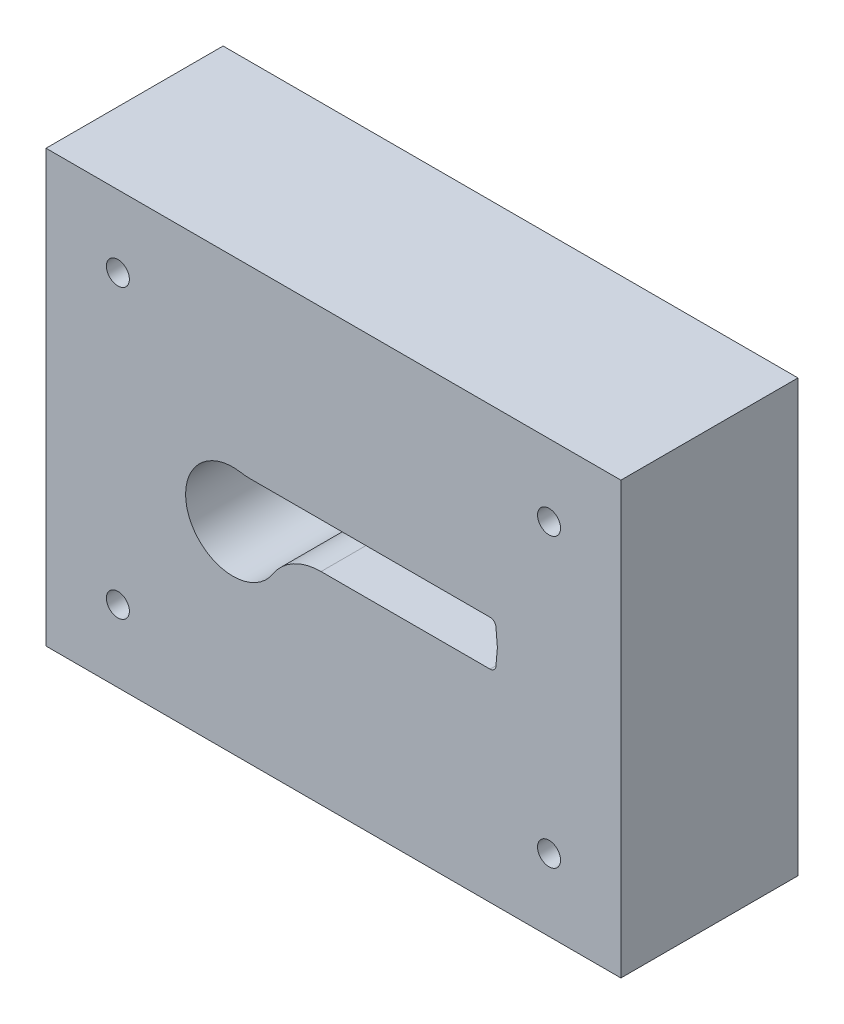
SolidWorks part; units mm, degrees
ref_plane "Plan1" through (0, 0, 0) normal (0, 0, 1) x (1, 0, 0)
ref_plane "Plan2" through (0, 0, 0) normal (0, 1, 0) x (1, 0, 0)
ref_plane "Plan3" through (0, 0, 0) normal (1, 0, 0) x (0, 0, -1)
sketch "Esquisse1" plane through (0, 0, 0) normal (0, 0, 1) x (1, 0, 0)
  line L1 (0, 0) -> (200, 0)
  line L2 (0, 0) -> (0, 150)
  line L3 (0, 150) -> (200, 150)
  line L4 (200, 0) -> (200, 150)
  dimension "D1" = 150
  dimension "D2" = 200
extrude "Base-Extrusion" add sketch "Esquisse1" along normal blind 65
sketch "Esquisse2" plane through (0, 0, 65) normal (0, 0, 1) x (1, 0, 0)
  line L0 (-10, 70) -> (90, 70) construction
  line L1 (0, 0) -> (200, 0) construction
  line L2 (20.3045, 78.12) -> (209.4484, 78.12) construction
  line L3 (71.0782, 85.935) -> (154.4898, 85.935)
  line L4 (156.5121, 84.0819) -> (157.0337, 78.12)
  line L5 (156.5121, 72.1581) -> (157.0337, 78.12)
  line L6 (95.6814, 70.305) -> (154.4898, 70.305)
  line L7 (200, 0) -> (200, 150) construction
  arc A0 (67.7404, 86.2151) -> (78.8329, 61.1069) centre (65, 70) ccw
  arc A1 (154.4898, 85.935) -> (156.5121, 84.0819) centre (154.4898, 83.905) cw
  arc A2 (71.0782, 85.935) -> (67.7404, 86.2151) centre (71.0782, 105.965) cw
  arc A3 (154.4898, 70.305) -> (156.5121, 72.1581) centre (154.4898, 72.335) ccw
  arc A4 (95.6814, 70.305) -> (78.8329, 61.1069) centre (95.6814, 50.275) ccw
  point P13 (156.35, 85.935)
  dimension "D2" = 32.89
  dimension "D6" = 91.35
  dimension "D7" = 2.03
  dimension "D8" = 20.03
  dimension "D9" = 20.03
  dimension "D10" = 135
  dimension "D1" = 70
  dimension "D3" = 8.12
  dimension "D4" = 7.815
  dimension "D5" = 95
extrude "Enlèv. mat.-Extru.1" cut sketch "Esquisse2" against normal through all
sketch "Esquisse3" plane through (0, 0, 0) normal (0, 0, -1) x (-1, 0, 0)
  line L5 (-210.7053, 159.8634) -> (12.6195, 159.8634)
  line L6 (-210.7053, 159.8634) -> (-210.7053, -13.0538)
  line L7 (-210.7053, -13.0538) -> (12.6195, -13.0538)
  line L8 (-161.049, 78.12) -> (-160.4969, 71.8095)
  line L9 (-160.4969, 84.4305) -> (-161.049, 78.12)
  line L10 (-71.0782, 89.935) -> (-154.4898, 89.935)
  line L11 (-154.4898, 66.305) -> (-95.6814, 66.305)
  line L12 (-161.049, 78.12) -> (-160.4969, 71.8095)
  line L13 (-160.4969, 84.4305) -> (-161.049, 78.12)
  line L14 (-71.0782, 89.935) -> (-154.4898, 89.935)
  line L15 (-154.4898, 66.305) -> (-95.6814, 66.305)
  line L16 (12.6195, 159.8634) -> (12.6195, -13.0538)
  arc A10 (-160.4969, 71.8095) -> (-154.4898, 66.305) centre (-154.4898, 72.335) ccw
  arc A11 (-154.4898, 89.935) -> (-160.4969, 84.4305) centre (-154.4898, 83.905) ccw
  arc A12 (-71.0782, 89.935) -> (-68.407, 90.1591) centre (-71.0782, 105.965) ccw
  arc A13 (-82.1976, 58.9437) -> (-68.407, 90.1591) centre (-65, 70) ccw
  arc A14 (-82.1976, 58.9437) -> (-95.6814, 66.305) centre (-95.6814, 50.275) ccw
  arc A15 (-160.4969, 71.8095) -> (-154.4898, 66.305) centre (-154.4898, 72.335) ccw
  arc A16 (-154.4898, 89.935) -> (-160.4969, 84.4305) centre (-154.4898, 83.905) ccw
  arc A17 (-71.0782, 89.935) -> (-68.407, 90.1591) centre (-71.0782, 105.965) ccw
  arc A18 (-82.1976, 58.9437) -> (-68.407, 90.1591) centre (-65, 70) ccw
  arc A19 (-82.1976, 58.9437) -> (-95.6814, 66.305) centre (-95.6814, 50.275) ccw
  dimension "D1" = 4
extrude "Enlèv. mat.-Extru.2" cut sketch "Esquisse3" against normal blind 3.4
fillet "Congé1" radius 3
hole_wizard "Trou taraudé M10x1.52" positions "Esquisse9" profile "Esquisse8" tap size "M10x1.5" standard "ISO"
sketch "Esquisse9" plane through (0, 0, 65) normal (0, 0, 1) x (1, 0, 0)
  line L0 (200, 150) -> (0, 150) construction
  line L1 (200, 0) -> (200, 150) construction
  line L3 (0, 0) -> (200, 0) construction
  point P0 (25, 125)
  point P1 (175, 125)
  point P2 (175, 25)
  point P3 (25, 25)
  dimension "D1" = 150
  dimension "D2" = 150
  dimension "D3" = 100
  dimension "D4" = 100
  dimension "D5" = 25
  dimension "D6" = 25
  dimension "D7" = 25
  dimension "D8" = 25
sketch "Esquisse8" plane through (25, 125, 65) normal (1, 0, 0) x (0, -1, 0)
  line L0 (0, 0) -> (0, 45.3094)
  line L1 (0, 45.3094) -> (4, 43)
  line L2 (4, 43) -> (4, 0)
  line L5 (4, 0) -> (0, 0)
  line L10 (0, 45.3094) -> (-4, 43) construction
  line L11 (0, -6.35) -> (0, 107.95) construction
  dimension "Diamètre du perçage" = 8
  dimension "Profondeur du perçage" = 43
  dimension "Angle de pointe" = 120
sketch "Esquisse10" plane through (0, 0, 65) normal (0, 0, 1) x (1, 0, 0)
  line L0 (-10, 70) -> (65, 70)
  line L1 (65, 70) -> (87.3095, 78.12)
  line L2 (32.8497, 78.12) -> (79.9626, 78.12) construction
  line L3 (87.3095, 78.12) -> (205.7024, 78.12)
  dimension "D1" = 160
extrude "Enlèv. mat.-Extru.3" [suppressed] cut sketch "Esquisse10" against normal through all and the other way through all flip side to cut
